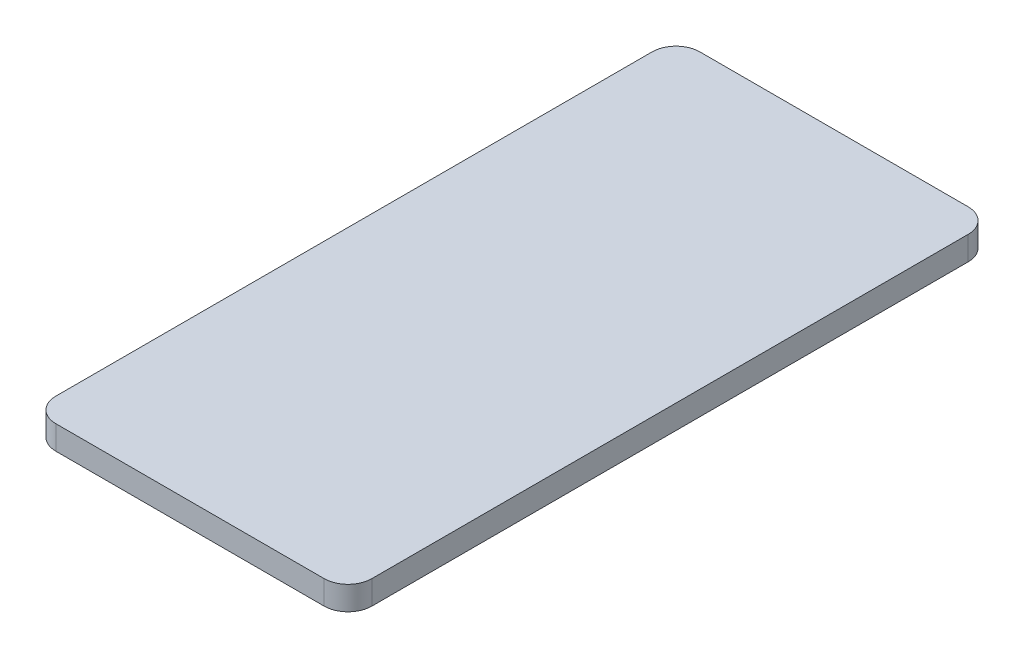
SolidWorks part; units mm, degrees
ref_plane "前视基准面" through (0, 0, 0) normal (0, 0, 1) x (1, 0, 0)
ref_plane "上视基准面" through (0, 0, 0) normal (0, 1, 0) x (1, 0, 0)
ref_plane "右视基准面" through (0, 0, 0) normal (1, 0, 0) x (0, 0, -1)
other "Configuration Table"
sketch "草图1" plane through (0, 0, 0) normal (0, 1, 0) x (1, 0, 0)
  line L1 (11.25, -27) -> (-11.25, -27)
  line L2 (13.25, -25) -> (13.25, 25)
  line L3 (11.25, 27) -> (-11.25, 27)
  line L4 (-13.25, -25) -> (-13.25, 25)
  line L5 (13.25, -27) -> (-13.25, 27) construction
  line L6 (13.25, 27) -> (-13.25, -27) construction
  arc A0 (-11.25, 27) -> (-13.25, 25) centre (-11.25, 25) ccw
  arc A1 (13.25, 25) -> (11.25, 27) centre (11.25, 25) ccw
  arc A2 (13.25, -25) -> (11.25, -27) centre (11.25, -25) cw
  arc A3 (-11.25, -27) -> (-13.25, -25) centre (-11.25, -25) cw
  point P0 (0, 0)
  dimension "D3" = 2
  dimension "D1" = 26.5
  dimension "D2" = 54
extrude "凸台-拉伸1" add sketch "草图1" along normal blind 2
